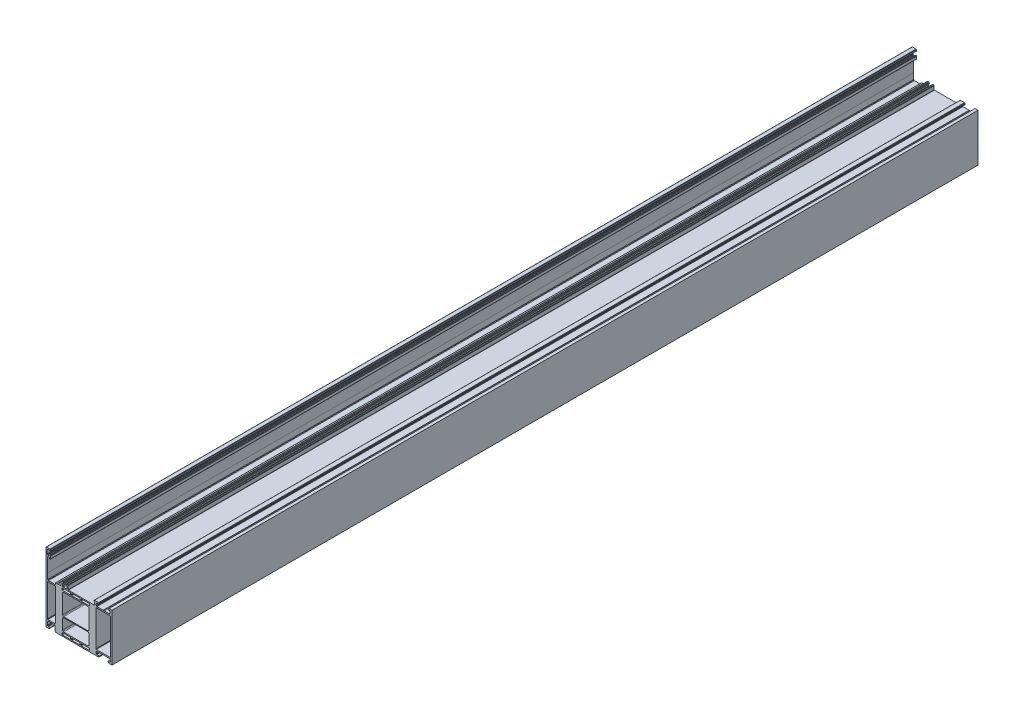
SolidWorks part; units mm, degrees
ref_plane "Ebene vorne" through (0, 0, 0) normal (0, 0, 1) x (1, 0, 0)
ref_plane "Ebene oben" through (0, 0, 0) normal (0, 1, 0) x (1, 0, 0)
ref_plane "Ebene rechts" through (0, 0, 0) normal (1, 0, 0) x (0, 0, -1)
sketch "Skizze1" plane through (0, 0, 0) normal (0, 0, 1) x (1, 0, 0)
  line L0 (15.4, 49) -> (16.2002, 49.0012)
  line L5 (1.85, 45.533) -> (1.9706, 45.583)
  line L6 (28.9408, 47.4176) -> (28.9038, 47.3119)
  line L7 (25.3003, 49.0607) -> (25.3415, 49.0285)
  line L8 (25.3415, 49.0285) -> (25.3896, 49.0079)
  line L9 (25.3896, 49.0079) -> (25.4414, 49.0001)
  line L10 (18.5413, 47.7007) -> (18.43, 47.6881)
  line L11 (47.2413, 44.1006) -> (20.2413, 44.1006)
  line L12 (20.2413, 44.1006) -> (19.9075, 44.063)
  line L13 (19.9075, 44.063) -> (19.5905, 43.9521)
  line L14 (19.5905, 43.9521) -> (19.3061, 43.7734)
  line L15 (19.3061, 43.7734) -> (19.0685, 43.5359)
  line L16 (19.0685, 43.5359) -> (18.8898, 43.2515)
  line L17 (18.8898, 43.2515) -> (18.7789, 42.9344)
  line L18 (18.7789, 42.9344) -> (18.7413, 42.6006)
  line L19 (18.7413, 42.6006) -> (18.7413, 21.6006)
  line L20 (1.6, 27) -> (1.6, 8.9)
  line L21 (1.6, 8.9) -> (1.6125, 8.7888)
  line L22 (1.6125, 8.7888) -> (1.6495, 8.6831)
  line L23 (1.6495, 8.6831) -> (1.7091, 8.5883)
  line L24 (1.7091, 8.5883) -> (1.7883, 8.5091)
  line L25 (1.7883, 8.5091) -> (1.8831, 8.4495)
  line L26 (1.8831, 8.4495) -> (1.9887, 8.4125)
  line L27 (1.9887, 8.4125) -> (2.1, 8.4)
  line L28 (2.1, 8.4) -> (10.3, 8.4)
  line L29 (10.3, 8.4) -> (10.4113, 8.4125)
  line L30 (10.4113, 8.4125) -> (10.5169, 8.4495)
  line L31 (10.5169, 8.4495) -> (10.6117, 8.5091)
  line L32 (10.6117, 8.5091) -> (10.6909, 8.5883)
  line L33 (10.6909, 8.5883) -> (10.7505, 8.6831)
  line L34 (10.7505, 8.6831) -> (10.7875, 8.7888)
  line L35 (10.7875, 8.7888) -> (10.8, 8.9)
  line L36 (10.8, 8.9) -> (10.8, 45.1)
  line L37 (10.8, 45.1) -> (10.7875, 45.2113)
  line L38 (10.7875, 45.2113) -> (10.7505, 45.317)
  line L39 (10.7505, 45.317) -> (10.6909, 45.4118)
  line L40 (10.6909, 45.4118) -> (10.6117, 45.4909)
  line L41 (10.6117, 45.4909) -> (10.5169, 45.5505)
  line L42 (10.5169, 45.5505) -> (10.4113, 45.5875)
  line L43 (10.4113, 45.5875) -> (10.3, 45.6)
  line L44 (10.3, 45.6) -> (2.1, 45.6)
  line L45 (2.1, 45.6) -> (1.9706, 45.583)
  line L46 (1.9706, 45.583) -> (1.85, 45.533)
  line L47 (1.85, 45.533) -> (1.7465, 45.4536)
  line L48 (1.7465, 45.4536) -> (1.667, 45.35)
  line L49 (1.667, 45.35) -> (1.617, 45.2294)
  line L50 (1.617, 45.2294) -> (1.6, 45.1)
  line L51 (1.6, 45.1) -> (1.6, 27)
  line L52 (0, 0) -> (0, 39.25)
  line L53 (0, 39.25) -> (0, 78.5)
  line L54 (0, 78.5) -> (0.0125, 78.6113)
  line L55 (0.0125, 78.6113) -> (0.0495, 78.7169)
  line L56 (0.0495, 78.7169) -> (0.1091, 78.8117)
  line L57 (0.1091, 78.8117) -> (0.1883, 78.8909)
  line L58 (0.1883, 78.8909) -> (0.2831, 78.9505)
  line L59 (0.2831, 78.9505) -> (0.3887, 78.9875)
  line L60 (0.3887, 78.9875) -> (0.5, 79)
  line L61 (0.5, 79) -> (4.5, 79)
  line L62 (4.5, 79) -> (4.6113, 78.9875)
  line L63 (4.6113, 78.9875) -> (4.7169, 78.9505)
  line L64 (4.7169, 78.9505) -> (4.8117, 78.8909)
  line L65 (4.8117, 78.8909) -> (4.8909, 78.8117)
  line L66 (4.8909, 78.8117) -> (4.9505, 78.7169)
  line L67 (4.9505, 78.7169) -> (4.9875, 78.6113)
  line L68 (4.9875, 78.6113) -> (5, 78.5)
  line L69 (5, 78.5) -> (5, 77.2)
  line L70 (5, 77.2) -> (4.9875, 77.0887)
  line L71 (4.9875, 77.0887) -> (4.9505, 76.983)
  line L72 (4.9505, 76.983) -> (4.8909, 76.8882)
  line L73 (4.8909, 76.8882) -> (4.8117, 76.8091)
  line L74 (4.8117, 76.8091) -> (4.7169, 76.7495)
  line L75 (4.7169, 76.7495) -> (4.6113, 76.7125)
  line L76 (4.6113, 76.7125) -> (4.5, 76.7)
  line L77 (4.5, 76.7) -> (4, 76.7)
  line L78 (4, 76.7) -> (4, 77.7)
  line L79 (4, 77.7) -> (2.3, 77.7)
  line L80 (2.3, 77.7) -> (2.0412, 77.6659)
  line L81 (2.0412, 77.6659) -> (1.8, 77.566)
  line L82 (1.8, 77.566) -> (1.5929, 77.4071)
  line L83 (1.5929, 77.4071) -> (1.434, 77.2)
  line L84 (1.434, 77.2) -> (1.3341, 76.9588)
  line L85 (1.3341, 76.9588) -> (1.3, 76.7)
  line L86 (1.3, 76.7) -> (1.3, 72.7)
  line L87 (1.3, 72.7) -> (1.3251, 72.4775)
  line L88 (1.3251, 72.4775) -> (1.399, 72.2661)
  line L89 (1.399, 72.2661) -> (1.5182, 72.0765)
  line L90 (1.5182, 72.0765) -> (1.6765, 71.9182)
  line L91 (1.6765, 71.9182) -> (1.8661, 71.799)
  line L92 (1.8661, 71.799) -> (2.0775, 71.7251)
  line L93 (2.0775, 71.7251) -> (2.3, 71.7)
  line L94 (2.3, 71.7) -> (4, 71.7)
  line L95 (4, 71.7) -> (4, 72.7)
  line L96 (4, 72.7) -> (4.5, 72.7)
  line L97 (4.5, 72.7) -> (4.6294, 72.683)
  line L98 (4.6294, 72.683) -> (4.75, 72.633)
  line L99 (4.75, 72.633) -> (4.8535, 72.5536)
  line L100 (4.8535, 72.5536) -> (4.933, 72.45)
  line L101 (4.933, 72.45) -> (4.983, 72.3294)
  line L102 (4.983, 72.3294) -> (5, 72.2)
  line L103 (5, 72.2) -> (5, 69.4)
  line L104 (5, 69.4) -> (4.9875, 69.2887)
  line L105 (4.9875, 69.2887) -> (4.9505, 69.1831)
  line L106 (4.9505, 69.1831) -> (4.8909, 69.0882)
  line L107 (4.8909, 69.0882) -> (4.8117, 69.0091)
  line L108 (4.8117, 69.0091) -> (4.7169, 68.9495)
  line L109 (4.7169, 68.9495) -> (4.6113, 68.9125)
  line L110 (4.6113, 68.9125) -> (4.5, 68.9)
  line L111 (4.5, 68.9) -> (4.3, 68.9)
  line L112 (4.3, 68.9) -> (4.1887, 68.9125)
  line L113 (4.1887, 68.9125) -> (4.0831, 68.9495)
  line L114 (4.0831, 68.9495) -> (3.9883, 69.0091)
  line L115 (3.9883, 69.0091) -> (3.9091, 69.0882)
  line L116 (3.9091, 69.0882) -> (3.8495, 69.1831)
  line L117 (3.8495, 69.1831) -> (3.8125, 69.2887)
  line L118 (3.8125, 69.2887) -> (3.8, 69.4)
  line L119 (3.8, 69.4) -> (3.8, 69.9)
  line L120 (3.8, 69.9) -> (3.783, 70.0294)
  line L121 (3.783, 70.0294) -> (3.733, 70.15)
  line L122 (3.733, 70.15) -> (3.6536, 70.2535)
  line L123 (3.6536, 70.2535) -> (3.55, 70.333)
  line L124 (3.55, 70.333) -> (3.4294, 70.383)
  line L125 (3.4294, 70.383) -> (3.3, 70.4)
  line L126 (3.3, 70.4) -> (2.1, 70.4)
  line L127 (2.1, 70.4) -> (1.9887, 70.3875)
  line L128 (1.9887, 70.3875) -> (1.8831, 70.3505)
  line L129 (1.8831, 70.3505) -> (1.7883, 70.2909)
  line L130 (1.7883, 70.2909) -> (1.7091, 70.2117)
  line L131 (1.7091, 70.2117) -> (1.6495, 70.1169)
  line L132 (1.6495, 70.1169) -> (1.6125, 70.0113)
  line L133 (1.6125, 70.0113) -> (1.6, 69.9)
  line L134 (1.6, 69.9) -> (1.6, 54)
  line L135 (1.6, 54) -> (1.9461, 47.943)
  line L136 (1.9461, 47.943) -> (1.992, 47.6956)
  line L137 (1.992, 47.6956) -> (2.0981, 47.4674)
  line L138 (2.0981, 47.4674) -> (2.2578, 47.273)
  line L139 (2.2578, 47.273) -> (2.461, 47.1246)
  line L140 (2.461, 47.1246) -> (2.6949, 47.0317)
  line L141 (2.6949, 47.0317) -> (2.9445, 47)
  line L142 (2.9445, 47) -> (10.1, 47)
  line L143 (10.1, 47) -> (10.2294, 47.017)
  line L144 (10.2294, 47.017) -> (10.35, 47.067)
  line L145 (10.35, 47.067) -> (10.4536, 47.1464)
  line L146 (10.4536, 47.1464) -> (10.533, 47.25)
  line L147 (10.533, 47.25) -> (10.583, 47.3706)
  line L148 (10.583, 47.3706) -> (10.6, 47.5)
  line L149 (10.6, 47.5) -> (10.6, 48.5)
  line L150 (10.6, 48.5) -> (10.6125, 48.6113)
  line L151 (10.6125, 48.6113) -> (10.6495, 48.7169)
  line L152 (10.6495, 48.7169) -> (10.7091, 48.8117)
  line L153 (10.7091, 48.8117) -> (10.7883, 48.8909)
  line L154 (10.7883, 48.8909) -> (10.8831, 48.9505)
  line L155 (10.8831, 48.9505) -> (10.9887, 48.9875)
  line L156 (10.9887, 48.9875) -> (11.1, 49)
  line L157 (11.1, 49) -> (12.5, 49)
  line L158 (12.5, 49) -> (12.5294, 48.9337)
  line L159 (12.5294, 48.9337) -> (12.5749, 48.8772)
  line L160 (12.5749, 48.8772) -> (12.6335, 48.8343)
  line L161 (12.6335, 48.8343) -> (12.7011, 48.808)
  line L162 (12.7011, 48.808) -> (12.7732, 48.8)
  line L163 (12.7732, 48.8) -> (13.2268, 48.8)
  line L164 (13.2268, 48.8) -> (13.2989, 48.808)
  line L165 (13.2989, 48.808) -> (13.3665, 48.8343)
  line L166 (13.3665, 48.8343) -> (13.4251, 48.8772)
  line L167 (13.4251, 48.8772) -> (13.4706, 48.9337)
  line L168 (13.4706, 48.9337) -> (13.5, 49)
  line L169 (13.5, 49) -> (15.4, 49)
  line L273 (15.3998, 0.1999) -> (13.4999, 0.1999)
  line L274 (13.4999, 0.1999) -> (13.4705, 0.2662)
  line L275 (13.4705, 0.2662) -> (13.4249, 0.3227)
  line L276 (13.4249, 0.3227) -> (13.3664, 0.3656)
  line L277 (13.3664, 0.3656) -> (13.2988, 0.3919)
  line L278 (13.2988, 0.3919) -> (13.2266, 0.3999)
  line L279 (13.2266, 0.3999) -> (12.7731, 0.3999)
  line L280 (12.7731, 0.3999) -> (12.701, 0.3919)
  line L281 (12.701, 0.3919) -> (12.6334, 0.3656)
  line L282 (12.6334, 0.3656) -> (12.5749, 0.3228)
  line L283 (12.5749, 0.3228) -> (12.5295, 0.2663)
  line L284 (12.5295, 0.2663) -> (12.5001, 0.2)
  line L285 (12.5001, 0.2) -> (11, 0.2)
  line L286 (11, 0.2) -> (10.8887, 0.2125)
  line L287 (10.8887, 0.2125) -> (10.7831, 0.2495)
  line L288 (10.7831, 0.2495) -> (10.6883, 0.3091)
  line L289 (10.6883, 0.3091) -> (10.6091, 0.3883)
  line L290 (10.6091, 0.3883) -> (10.5495, 0.4831)
  line L291 (10.5495, 0.4831) -> (10.5125, 0.5888)
  line L292 (10.5125, 0.5888) -> (10.5, 0.7)
  line L293 (10.5, 0.7) -> (10.5, 6.5)
  line L294 (10.5, 6.5) -> (10.4875, 6.6113)
  line L295 (10.4875, 6.6113) -> (10.4505, 6.7169)
  line L296 (10.4505, 6.7169) -> (10.3909, 6.8117)
  line L297 (10.3909, 6.8117) -> (10.3117, 6.8909)
  line L298 (10.3117, 6.8909) -> (10.2169, 6.9505)
  line L299 (10.2169, 6.9505) -> (10.1113, 6.9875)
  line L300 (10.1113, 6.9875) -> (10, 7)
  line L301 (10, 7) -> (2.8, 7)
  line L302 (2.8, 7) -> (2.5412, 6.9659)
  line L303 (2.5412, 6.9659) -> (2.3, 6.866)
  line L304 (2.3, 6.866) -> (2.0929, 6.7071)
  line L305 (2.0929, 6.7071) -> (1.934, 6.5)
  line L306 (1.934, 6.5) -> (1.8341, 6.2588)
  line L307 (1.8341, 6.2588) -> (1.8, 6)
  line L308 (1.8, 6) -> (1.8, 2.7)
  line L309 (1.8, 2.7) -> (1.8251, 2.4775)
  line L310 (1.8251, 2.4775) -> (1.899, 2.2661)
  line L311 (1.899, 2.2661) -> (2.0182, 2.0765)
  line L312 (2.0182, 2.0765) -> (2.1765, 1.9182)
  line L313 (2.1765, 1.9182) -> (2.3661, 1.799)
  line L314 (2.3661, 1.799) -> (2.5775, 1.7251)
  line L315 (2.5775, 1.7251) -> (2.8, 1.7)
  line L316 (2.8, 1.7) -> (4.5, 1.7)
  line L317 (4.5, 1.7) -> (4.5, 1.1)
  line L318 (4.5, 1.1) -> (3.4, 0)
  line L319 (3.4, 0) -> (0, 0)
  line L320 (29.04, 45.5493) -> (29.0795, 45.5097)
  line L321 (29.0795, 45.5097) -> (29.1743, 45.4502)
  line L322 (29.1743, 45.4502) -> (29.28, 45.4132)
  line L323 (29.28, 45.4132) -> (29.3913, 45.4006)
  line L324 (29.3913, 45.4006) -> (38.0913, 45.4006)
  line L325 (38.0913, 45.4006) -> (38.2207, 45.4177)
  line L326 (38.2207, 45.4177) -> (38.3413, 45.4676)
  line L327 (38.3413, 45.4676) -> (38.4448, 45.5471)
  line L328 (38.4448, 45.5471) -> (38.5243, 45.6506)
  line L329 (38.5243, 45.6506) -> (38.5743, 45.7712)
  line L330 (38.5743, 45.7712) -> (38.5913, 45.9006)
  line L331 (38.5913, 45.9006) -> (38.5913, 47.2007)
  line L332 (38.5913, 47.2007) -> (38.5788, 47.3119)
  line L333 (38.5788, 47.3119) -> (38.5418, 47.4176)
  line L334 (38.5418, 47.4176) -> (38.4822, 47.5124)
  line L335 (38.4822, 47.5124) -> (38.403, 47.5916)
  line L336 (38.403, 47.5916) -> (38.3082, 47.6511)
  line L337 (38.3082, 47.6511) -> (38.2026, 47.6881)
  line L338 (38.2026, 47.6881) -> (38.0913, 47.7007)
  line L339 (38.0913, 47.7007) -> (29.3913, 47.7007)
  line L340 (29.3913, 47.7007) -> (29.28, 47.6881)
  line L341 (29.28, 47.6881) -> (29.1743, 47.6511)
  line L342 (29.1743, 47.6511) -> (29.0795, 47.5916)
  line L343 (29.0795, 47.5916) -> (29.0004, 47.5124)
  line L344 (29.0004, 47.5124) -> (28.9408, 47.4176)
  line L345 (28.9408, 47.4176) -> (28.9038, 47.3119)
  line L346 (28.9038, 47.3119) -> (28.8913, 47.2007)
  line L347 (28.8913, 47.2007) -> (28.8913, 45.9006)
  line L348 (28.8913, 45.9006) -> (28.9038, 45.7894)
  line L349 (28.9038, 45.7894) -> (28.9408, 45.6837)
  line L350 (28.9408, 45.6837) -> (29.0004, 45.5889)
  line L351 (29.0004, 45.5889) -> (29.04, 45.5493)
  line L352 (22.9663, 47.7007) -> (18.5413, 47.7007)
  line L353 (18.5413, 47.7007) -> (18.43, 47.6881)
  line L354 (18.43, 47.6881) -> (18.3243, 47.6511)
  line L355 (18.3243, 47.6511) -> (18.2295, 47.5916)
  line L356 (18.2295, 47.5916) -> (18.1504, 47.5124)
  line L357 (18.1504, 47.5124) -> (18.0908, 47.4176)
  line L358 (18.0908, 47.4176) -> (18.0538, 47.3119)
  line L359 (18.0538, 47.3119) -> (18.0413, 47.2007)
  line L360 (18.0413, 47.2007) -> (18.0413, 45.9007)
  line L361 (18.0413, 45.9007) -> (18.0538, 45.7894)
  line L362 (18.0538, 45.7894) -> (18.0908, 45.6837)
  line L363 (18.0908, 45.6837) -> (18.1504, 45.5889)
  line L364 (18.1504, 45.5889) -> (18.2296, 45.5097)
  line L365 (18.2296, 45.5097) -> (18.3244, 45.4502)
  line L366 (18.3244, 45.4502) -> (18.43, 45.4132)
  line L367 (18.43, 45.4132) -> (18.5413, 45.4006)
  line L368 (18.5413, 45.4006) -> (27.3913, 45.4006)
  line L369 (27.3913, 45.4006) -> (27.4469, 45.4069)
  line L370 (27.4469, 45.4069) -> (27.5025, 45.4132)
  line L371 (27.5025, 45.4132) -> (27.6082, 45.4502)
  line L372 (27.6082, 45.4502) -> (27.703, 45.5097)
  line L373 (27.703, 45.5097) -> (27.7822, 45.5889)
  line L374 (27.7822, 45.5889) -> (27.8418, 45.6837)
  line L375 (27.8418, 45.6837) -> (27.8788, 45.7894)
  line L376 (27.8788, 45.7894) -> (27.8913, 45.9006)
  line L377 (27.8913, 45.9006) -> (27.8913, 47.2006)
  line L378 (27.8913, 47.2006) -> (27.8788, 47.3119)
  line L379 (27.8788, 47.3119) -> (27.8418, 47.4176)
  line L380 (27.8418, 47.4176) -> (27.7822, 47.5124)
  line L381 (27.7822, 47.5124) -> (27.703, 47.5916)
  line L382 (27.703, 47.5916) -> (27.6082, 47.6511)
  line L383 (27.6082, 47.6511) -> (27.5026, 47.6881)
  line L384 (27.5026, 47.6881) -> (27.3913, 47.7007)
  line L385 (27.3913, 47.7007) -> (22.9663, 47.7007)
  line L386 (25.4414, 49.0001) -> (38.362, 49.0001)
  line L387 (38.362, 49.0001) -> (44.8224, 49.0001)
  line L388 (44.8224, 49.0001) -> (52.1201, 49.0001)
  line L424 (47.2451, 44.1002) -> (33.7413, 44.1006)
  line L460 (16.2002, 49.0012) -> (17.0413, 49.0025)
  line L461 (17.0413, 49.0025) -> (17.0858, 49.0075)
  line L462 (17.0858, 49.0075) -> (17.1281, 49.0223)
  line L463 (17.1281, 49.0223) -> (17.166, 49.0462)
  line L464 (17.166, 49.0462) -> (17.1977, 49.0778)
  line L465 (17.1977, 49.0778) -> (17.2215, 49.1158)
  line L466 (17.2215, 49.1158) -> (17.2363, 49.158)
  line L467 (17.2363, 49.158) -> (17.2413, 49.2025)
  line L468 (17.2413, 49.2025) -> (17.2413, 53.3025)
  line L469 (17.2413, 53.3025) -> (17.2538, 53.4138)
  line L470 (17.2538, 53.4138) -> (17.2908, 53.5195)
  line L471 (17.2908, 53.5195) -> (17.3504, 53.6143)
  line L472 (17.3504, 53.6143) -> (17.4296, 53.6935)
  line L473 (17.4296, 53.6935) -> (17.5244, 53.753)
  line L474 (17.5244, 53.753) -> (17.63, 53.79)
  line L475 (17.63, 53.79) -> (17.7413, 53.8025)
  line L476 (17.7413, 53.8025) -> (18.572, 53.8025)
  line L477 (18.572, 53.8025) -> (18.8309, 53.7685)
  line L478 (18.8309, 53.7685) -> (19.072, 53.6686)
  line L479 (19.072, 53.6686) -> (19.2792, 53.5096)
  line L480 (19.2792, 53.5096) -> (19.4381, 53.3025)
  line L481 (19.4381, 53.3025) -> (19.538, 53.0614)
  line L482 (19.538, 53.0614) -> (19.7413, 52.3025)
  line L483 (19.7413, 52.3025) -> (18.7413, 52.3025)
  line L484 (18.7413, 52.3025) -> (18.7413, 50.0025)
  line L485 (18.7413, 50.0025) -> (18.7757, 49.7436)
  line L486 (18.7757, 49.7436) -> (18.8757, 49.5024)
  line L487 (18.8757, 49.5024) -> (19.0346, 49.2951)
  line L488 (19.0346, 49.2951) -> (19.2415, 49.1357)
  line L489 (19.2415, 49.1357) -> (19.4825, 49.0351)
  line L490 (19.4825, 49.0351) -> (19.7413, 49.0001)
  line L491 (19.7413, 49.0001) -> (22.7412, 49.0001)
  line L492 (22.7412, 49.0001) -> (23, 49.0351)
  line L493 (23, 49.0351) -> (23.2411, 49.1357)
  line L494 (23.2411, 49.1357) -> (23.448, 49.295)
  line L495 (23.448, 49.295) -> (23.6069, 49.5024)
  line L496 (23.6069, 49.5024) -> (23.7069, 49.7436)
  line L497 (23.7069, 49.7436) -> (23.7413, 50.0025)
  line L498 (23.7413, 50.0025) -> (23.7413, 52.3025)
  line L499 (23.7413, 52.3025) -> (22.7413, 52.3025)
  line L500 (22.7413, 52.3025) -> (22.9446, 53.0614)
  line L501 (22.9446, 53.0614) -> (23.0445, 53.3025)
  line L502 (23.0445, 53.3025) -> (23.2034, 53.5096)
  line L503 (23.2034, 53.5096) -> (23.4105, 53.6686)
  line L504 (23.4105, 53.6686) -> (23.6517, 53.7685)
  line L505 (23.6517, 53.7685) -> (23.9105, 53.8025)
  line L506 (23.9105, 53.8025) -> (24.7413, 53.8025)
  line L507 (24.7413, 53.8025) -> (24.8526, 53.79)
  line L508 (24.8526, 53.79) -> (24.9582, 53.753)
  line L509 (24.9582, 53.753) -> (25.053, 53.6934)
  line L510 (25.053, 53.6934) -> (25.1322, 53.6143)
  line L511 (25.1322, 53.6143) -> (25.1918, 53.5195)
  line L512 (25.1918, 53.5195) -> (25.2288, 53.4138)
  line L513 (25.2288, 53.4138) -> (25.2413, 53.3025)
  line L514 (25.2413, 53.3025) -> (25.2413, 49.2025)
  line L515 (25.2413, 49.2025) -> (25.2484, 49.1507)
  line L516 (25.2484, 49.1507) -> (25.2685, 49.1024)
  line L517 (25.2685, 49.1024) -> (25.3003, 49.0607)
  line L518 (25.3003, 49.0607) -> (25.4414, 49.0001)
  line L519 (48.7414, 17.5996) -> (48.7414, 6.5996)
  line L520 (48.7414, 6.5996) -> (48.7038, 6.2658)
  line L521 (48.7038, 6.2658) -> (48.5929, 5.9487)
  line L522 (48.5929, 5.9487) -> (48.4142, 5.6643)
  line L523 (48.4142, 5.6643) -> (48.1766, 5.4268)
  line L524 (48.1766, 5.4268) -> (47.8922, 5.2481)
  line L525 (47.8922, 5.2481) -> (47.5752, 5.1372)
  line L526 (47.5752, 5.1372) -> (47.2414, 5.0996)
  line L527 (47.2414, 5.0996) -> (20.2414, 5.0996)
  line L528 (20.2414, 5.0996) -> (19.9076, 5.1372)
  line L529 (19.9076, 5.1372) -> (19.5906, 5.2481)
  line L530 (19.5906, 5.2481) -> (19.3062, 5.4268)
  line L531 (19.3062, 5.4268) -> (19.0687, 5.6643)
  line L532 (19.0687, 5.6643) -> (18.89, 5.9487)
  line L533 (18.89, 5.9487) -> (18.779, 6.2658)
  line L534 (18.779, 6.2658) -> (18.7414, 6.5996)
  line L535 (18.7414, 6.5996) -> (18.7414, 17.5996)
  line L536 (18.7414, 17.5996) -> (18.779, 17.9334)
  line L537 (18.779, 17.9334) -> (18.89, 18.2504)
  line L538 (18.89, 18.2504) -> (19.0687, 18.5348)
  line L539 (19.0687, 18.5348) -> (19.3062, 18.7723)
  line L540 (19.3062, 18.7723) -> (19.5906, 18.951)
  line L541 (19.5906, 18.951) -> (19.9076, 19.062)
  line L542 (19.9076, 19.062) -> (20.2414, 19.0996)
  line L543 (20.2414, 19.0996) -> (47.2414, 19.0996)
  line L544 (47.2414, 19.0996) -> (47.5752, 19.062)
  line L545 (47.5752, 19.062) -> (47.8922, 18.951)
  line L546 (47.8922, 18.951) -> (48.1766, 18.7723)
  line L547 (48.1766, 18.7723) -> (48.4142, 18.5348)
  line L548 (48.4142, 18.5348) -> (48.5929, 18.2504)
  line L549 (48.5929, 18.2504) -> (48.7038, 17.9334)
  line L550 (48.7038, 17.9334) -> (48.7414, 17.5996)
  line L551 (38.3084, 3.75) -> (38.2027, 3.787)
  line L553 (27.6084, 3.75) -> (27.5027, 3.787)
  line L554 (39.6408, 47.4176) -> (39.6038, 47.3119)
  line L555 (47.5751, 44.063) -> (47.2413, 44.1006)
  line L556 (18.7413, 21.6006) -> (18.7789, 21.2669)
  line L557 (18.7789, 21.2669) -> (18.8898, 20.9498)
  line L558 (18.8898, 20.9498) -> (19.0685, 20.6654)
  line L559 (19.0685, 20.6654) -> (19.3061, 20.4279)
  line L560 (19.3061, 20.4279) -> (19.5905, 20.2492)
  line L561 (19.5905, 20.2492) -> (19.9075, 20.1382)
  line L562 (19.9075, 20.1382) -> (20.2413, 20.1006)
  line L563 (20.2413, 20.1006) -> (47.2413, 20.1006)
  line L564 (47.2413, 20.1006) -> (47.5751, 20.1382)
  line L565 (47.5751, 20.1382) -> (47.8921, 20.2492)
  line L566 (47.8921, 20.2492) -> (48.1765, 20.4279)
  line L567 (48.1765, 20.4279) -> (48.414, 20.6654)
  line L568 (48.414, 20.6654) -> (48.5927, 20.9498)
  line L569 (48.5927, 20.9498) -> (48.7037, 21.2669)
  line L570 (48.7037, 21.2669) -> (48.7413, 21.6006)
  line L571 (48.7413, 21.6006) -> (48.7413, 42.6006)
  line L572 (48.7413, 42.6006) -> (48.7037, 42.9344)
  line L573 (48.7037, 42.9344) -> (48.5927, 43.2515)
  line L574 (48.5927, 43.2515) -> (48.414, 43.5359)
  line L575 (48.414, 43.5359) -> (48.1765, 43.7734)
  line L576 (48.1765, 43.7734) -> (47.8921, 43.9521)
  line L577 (47.8921, 43.9521) -> (47.5751, 44.063)
  line L578 (73.3998, 27) -> (73.3998, 47)
  line L579 (73.3998, 47) -> (73.3828, 47.1294)
  line L580 (73.3828, 47.1294) -> (73.3328, 47.25)
  line L581 (73.3328, 47.25) -> (73.2534, 47.3535)
  line L582 (73.2534, 47.3535) -> (73.1498, 47.433)
  line L583 (73.1498, 47.433) -> (73.0292, 47.4829)
  line L584 (73.0292, 47.4829) -> (72.8998, 47.5)
  line L585 (72.8998, 47.5) -> (57.1998, 47.5)
  line L586 (57.1998, 47.5) -> (57.0704, 47.4829)
  line L587 (57.0704, 47.4829) -> (56.9498, 47.433)
  line L588 (56.9498, 47.433) -> (56.8463, 47.3535)
  line L589 (56.8463, 47.3535) -> (56.7668, 47.25)
  line L590 (56.7668, 47.25) -> (56.7169, 47.1294)
  line L591 (56.7169, 47.1294) -> (56.6998, 47)
  line L592 (56.6998, 47) -> (56.6998, 7.0001)
  line L593 (56.6998, 7.0001) -> (56.7169, 6.8707)
  line L594 (56.7169, 6.8707) -> (56.7668, 6.7501)
  line L595 (56.7668, 6.7501) -> (56.8463, 6.6465)
  line L596 (56.8463, 6.6465) -> (56.9498, 6.5671)
  line L597 (56.9498, 6.5671) -> (57.0704, 6.5171)
  line L598 (57.0704, 6.5171) -> (57.1998, 6.5001)
  line L599 (57.1998, 6.5001) -> (72.8998, 6.5001)
  line L600 (72.8998, 6.5001) -> (73.0292, 6.5171)
  line L601 (73.0292, 6.5171) -> (73.1498, 6.5671)
  line L602 (73.1498, 6.5671) -> (73.2534, 6.6465)
  line L603 (73.2534, 6.6465) -> (73.3328, 6.7501)
  line L604 (73.3328, 6.7501) -> (73.3828, 6.8707)
  line L605 (73.3828, 6.8707) -> (73.3998, 7.0001)
  line L606 (73.3998, 7.0001) -> (73.3998, 27)
  line L607 (74.9998, 54) -> (74.9998, 27)
  line L608 (74.9998, 27) -> (74.9998, 0.0001)
  line L609 (74.9998, 0.0001) -> (71.5998, 0.0001)
  line L610 (71.5998, 0.0001) -> (70.4998, 1.1001)
  line L611 (70.4998, 1.1001) -> (70.4998, 1.7001)
  line L612 (70.4998, 1.7001) -> (72.2998, 1.7001)
  line L613 (72.2998, 1.7001) -> (72.5587, 1.7342)
  line L614 (72.5587, 1.7342) -> (72.7998, 1.8341)
  line L615 (72.7998, 1.8341) -> (73.0069, 1.993)
  line L616 (73.0069, 1.993) -> (73.1658, 2.2001)
  line L617 (73.1658, 2.2001) -> (73.2658, 2.4413)
  line L618 (73.2658, 2.4413) -> (73.2998, 2.7001)
  line L619 (73.2998, 2.7001) -> (73.2998, 4.0001)
  line L620 (73.2998, 4.0001) -> (73.2658, 4.2589)
  line L621 (73.2658, 4.2589) -> (73.1659, 4.5001)
  line L622 (73.1659, 4.5001) -> (73.0069, 4.7072)
  line L623 (73.0069, 4.7072) -> (72.7998, 4.8661)
  line L624 (72.7998, 4.8661) -> (72.5587, 4.966)
  line L625 (72.5587, 4.966) -> (72.2998, 5.0001)
  line L626 (72.2998, 5.0001) -> (65.9998, 5.0001)
  line L627 (65.9998, 5.0001) -> (65.8521, 5.1088)
  line L628 (65.8521, 5.1088) -> (65.6818, 5.1769)
  line L629 (65.6818, 5.1769) -> (65.4998, 5.2001)
  line L630 (65.4998, 5.2001) -> (65.3179, 5.1769)
  line L631 (65.3179, 5.1769) -> (65.1476, 5.1088)
  line L632 (65.1476, 5.1088) -> (64.9998, 5.0001)
  line L633 (64.9998, 5.0001) -> (57.9998, 5.0001)
  line L634 (57.9998, 5.0001) -> (57.7773, 4.975)
  line L635 (57.7773, 4.975) -> (57.5659, 4.901)
  line L636 (57.5659, 4.901) -> (57.3763, 4.7819)
  line L637 (57.3763, 4.7819) -> (57.218, 4.6236)
  line L638 (57.218, 4.6236) -> (57.0988, 4.434)
  line L639 (57.0988, 4.434) -> (57.0249, 4.2226)
  line L640 (57.0249, 4.2226) -> (56.9998, 4.0001)
  line L641 (56.9998, 4.0001) -> (56.9998, 2.7001)
  line L642 (56.9998, 2.7001) -> (57.0339, 2.4413)
  line L643 (57.0339, 2.4413) -> (57.1338, 2.2001)
  line L644 (57.1338, 2.2001) -> (57.2927, 1.993)
  line L645 (57.2927, 1.993) -> (57.4998, 1.8341)
  line L646 (57.4998, 1.8341) -> (57.741, 1.7342)
  line L647 (57.741, 1.7342) -> (57.9998, 1.7001)
  line L648 (57.9998, 1.7001) -> (60.4998, 1.7001)
  line L649 (60.4998, 1.7001) -> (60.4998, 1.2001)
  line L650 (60.4998, 1.2001) -> (60.4657, 0.9413)
  line L651 (60.4657, 0.9413) -> (60.3658, 0.7001)
  line L652 (60.3658, 0.7001) -> (60.2069, 0.493)
  line L653 (60.2069, 0.493) -> (59.9998, 0.3341)
  line L654 (59.9998, 0.3341) -> (59.7586, 0.2342)
  line L655 (59.7586, 0.2342) -> (59.4998, 0.2001)
  line L656 (59.4998, 0.2001) -> (55.0001, 0.2001)
  line L657 (55.0001, 0.2001) -> (54.9708, 0.2664)
  line L658 (54.9708, 0.2664) -> (54.9252, 0.3229)
  line L659 (54.9252, 0.3229) -> (54.8667, 0.3658)
  line L660 (54.8667, 0.3658) -> (54.7991, 0.3921)
  line L661 (54.7991, 0.3921) -> (54.727, 0.4001)
  line L662 (54.727, 0.4001) -> (54.2734, 0.4001)
  line L663 (54.2734, 0.4001) -> (54.2012, 0.3921)
  line L664 (54.2012, 0.3921) -> (54.1336, 0.3658)
  line L665 (54.1336, 0.3658) -> (54.0751, 0.3229)
  line L666 (54.0751, 0.3229) -> (54.0296, 0.2664)
  line L667 (54.0296, 0.2664) -> (54.0002, 0.2001)
  line L668 (54.0002, 0.2001) -> (52.1201, 0.2001)
  line L773 (52.1201, 49.0001) -> (54.0001, 49.0001)
  line L774 (54.0001, 49.0001) -> (54.0295, 48.9338)
  line L775 (54.0295, 48.9338) -> (54.075, 48.8772)
  line L776 (54.075, 48.8772) -> (54.1336, 48.8344)
  line L777 (54.1336, 48.8344) -> (54.2012, 48.8081)
  line L778 (54.2012, 48.8081) -> (54.2733, 48.8001)
  line L779 (54.2733, 48.8001) -> (54.7269, 48.8001)
  line L780 (54.7269, 48.8001) -> (54.7892, 48.8059)
  line L781 (54.7892, 48.8059) -> (54.8487, 48.8254)
  line L782 (54.8487, 48.8254) -> (54.9024, 48.8577)
  line L783 (54.9024, 48.8577) -> (54.9474, 48.9011)
  line L784 (54.9474, 48.9011) -> (54.9817, 48.9535)
  line L785 (54.9817, 48.9535) -> (55.0034, 49.0123)
  line L786 (55.0034, 49.0123) -> (55.0803, 49.0232)
  line L787 (55.0803, 49.0232) -> (55.1519, 49.0536)
  line L788 (55.1519, 49.0536) -> (55.2132, 49.1014)
  line L789 (55.2132, 49.1014) -> (55.2602, 49.1633)
  line L790 (55.2602, 49.1633) -> (55.2898, 49.2352)
  line L791 (55.2898, 49.2352) -> (55.2998, 49.3122)
  line L792 (55.2998, 49.3122) -> (55.2998, 52.3)
  line L793 (55.2998, 52.3) -> (54.4998, 52.3)
  line L794 (54.4998, 52.3) -> (54.4998, 53.3)
  line L795 (54.4998, 53.3) -> (54.5124, 53.4112)
  line L796 (54.5124, 53.4112) -> (54.5493, 53.5169)
  line L797 (54.5493, 53.5169) -> (54.6089, 53.6117)
  line L798 (54.6089, 53.6117) -> (54.6881, 53.6909)
  line L799 (54.6881, 53.6909) -> (54.7829, 53.7505)
  line L800 (54.7829, 53.7505) -> (54.8886, 53.7874)
  line L801 (54.8886, 53.7874) -> (54.9998, 53.8)
  line L802 (54.9998, 53.8) -> (59.4998, 53.8)
  line L803 (59.4998, 53.8) -> (59.7586, 53.7659)
  line L804 (59.7586, 53.7659) -> (59.9998, 53.666)
  line L805 (59.9998, 53.666) -> (60.2069, 53.5071)
  line L806 (60.2069, 53.5071) -> (60.3658, 53.3)
  line L807 (60.3658, 53.3) -> (60.4657, 53.0588)
  line L808 (60.4657, 53.0588) -> (60.4998, 52.8)
  line L809 (60.4998, 52.8) -> (60.4998, 52.3)
  line L810 (60.4998, 52.3) -> (57.9998, 52.3)
  line L811 (57.9998, 52.3) -> (57.741, 52.2659)
  line L812 (57.741, 52.2659) -> (57.4998, 52.166)
  line L813 (57.4998, 52.166) -> (57.2927, 52.0071)
  line L814 (57.2927, 52.0071) -> (57.1338, 51.8)
  line L815 (57.1338, 51.8) -> (57.0339, 51.5588)
  line L816 (57.0339, 51.5588) -> (56.9998, 51.3)
  line L817 (56.9998, 51.3) -> (56.9998, 50)
  line L818 (56.9998, 50) -> (57.0339, 49.7412)
  line L819 (57.0339, 49.7412) -> (57.1338, 49.5)
  line L820 (57.1338, 49.5) -> (57.2927, 49.2929)
  line L821 (57.2927, 49.2929) -> (57.4998, 49.134)
  line L822 (57.4998, 49.134) -> (57.741, 49.0341)
  line L823 (57.741, 49.0341) -> (57.9998, 49)
  line L824 (57.9998, 49) -> (64.9998, 49)
  line L825 (64.9998, 49) -> (65.1476, 48.8913)
  line L826 (65.1476, 48.8913) -> (65.3179, 48.8231)
  line L827 (65.3179, 48.8231) -> (65.4998, 48.7999)
  line L828 (65.4998, 48.7999) -> (65.6818, 48.8231)
  line L829 (65.6818, 48.8231) -> (65.8521, 48.8913)
  line L830 (65.8521, 48.8913) -> (65.9998, 49)
  line L831 (65.9998, 49) -> (72.0003, 49)
  line L832 (72.0003, 49) -> (72.2591, 49.0341)
  line L833 (72.2591, 49.0341) -> (72.5003, 49.134)
  line L834 (72.5003, 49.134) -> (72.7074, 49.2929)
  line L835 (72.7074, 49.2929) -> (72.8663, 49.5)
  line L836 (72.8663, 49.5) -> (72.9662, 49.7412)
  line L837 (72.9662, 49.7412) -> (73.0003, 50)
  line L838 (73.0003, 50) -> (73.0003, 51.3)
  line L839 (73.0003, 51.3) -> (72.9662, 51.5588)
  line L840 (72.9662, 51.5588) -> (72.8663, 51.8)
  line L841 (72.8663, 51.8) -> (72.7074, 52.0071)
  line L842 (72.7074, 52.0071) -> (72.5003, 52.166)
  line L843 (72.5003, 52.166) -> (72.2591, 52.2659)
  line L844 (72.2591, 52.2659) -> (72.0003, 52.3)
  line L845 (72.0003, 52.3) -> (70.4998, 52.3)
  line L846 (70.4998, 52.3) -> (70.4998, 52.9)
  line L847 (70.4998, 52.9) -> (71.5998, 54)
  line L848 (71.5998, 54) -> (74.9998, 54)
  line L849 (48.9969, 47.6944) -> (48.9413, 47.7007)
  line L850 (48.9413, 47.7007) -> (40.0913, 47.7007)
  line L851 (40.0913, 47.7007) -> (39.98, 47.6881)
  line L852 (39.98, 47.6881) -> (39.8743, 47.6511)
  line L853 (39.8743, 47.6511) -> (39.7795, 47.5916)
  line L854 (39.7795, 47.5916) -> (39.7004, 47.5124)
  line L855 (39.7004, 47.5124) -> (39.6408, 47.4176)
  line L856 (39.6408, 47.4176) -> (39.6038, 47.3119)
  line L857 (39.6038, 47.3119) -> (39.5913, 47.2006)
  line L858 (39.5913, 47.2006) -> (39.5913, 45.9006)
  line L859 (39.5913, 45.9006) -> (39.6038, 45.7894)
  line L860 (39.6038, 45.7894) -> (39.6408, 45.6837)
  line L861 (39.6408, 45.6837) -> (39.7004, 45.5889)
  line L862 (39.7004, 45.5889) -> (39.7795, 45.5097)
  line L863 (39.7795, 45.5097) -> (39.8743, 45.4502)
  line L864 (39.8743, 45.4502) -> (39.98, 45.4132)
  line L865 (39.98, 45.4132) -> (40.0913, 45.4006)
  line L866 (40.0913, 45.4006) -> (48.9413, 45.4006)
  line L867 (48.9413, 45.4006) -> (49.0525, 45.4132)
  line L868 (49.0525, 45.4132) -> (49.1582, 45.4502)
  line L869 (49.1582, 45.4502) -> (49.253, 45.5097)
  line L870 (49.253, 45.5097) -> (49.3322, 45.5889)
  line L871 (49.3322, 45.5889) -> (49.3918, 45.6837)
  line L872 (49.3918, 45.6837) -> (49.4288, 45.7894)
  line L873 (49.4288, 45.7894) -> (49.4413, 45.9006)
  line L874 (49.4413, 45.9006) -> (49.4413, 47.2006)
  line L875 (49.4413, 47.2006) -> (49.4288, 47.3119)
  line L876 (49.4288, 47.3119) -> (49.3918, 47.4176)
  line L877 (49.3918, 47.4176) -> (49.3322, 47.5124)
  line L878 (49.3322, 47.5124) -> (49.253, 47.5916)
  line L879 (49.253, 47.5916) -> (49.1582, 47.6511)
  line L880 (49.1582, 47.6511) -> (49.0525, 47.6881)
  line L881 (49.0525, 47.6881) -> (48.9969, 47.6944)
  line L882 (38.147, 3.7933) -> (38.0914, 3.7996)
  line L883 (38.0914, 3.7996) -> (29.3914, 3.7996)
  line L884 (29.3914, 3.7996) -> (29.262, 3.7825)
  line L885 (29.262, 3.7825) -> (29.1414, 3.7326)
  line L886 (29.1414, 3.7326) -> (29.0379, 3.6531)
  line L887 (29.0379, 3.6531) -> (28.9584, 3.5496)
  line L888 (28.9584, 3.5496) -> (28.9084, 3.429)
  line L889 (28.9084, 3.429) -> (28.8914, 3.2996)
  line L890 (28.8914, 3.2996) -> (28.8914, 1.9996)
  line L891 (28.8914, 1.9996) -> (28.9039, 1.8883)
  line L892 (28.9039, 1.8883) -> (28.9409, 1.7826)
  line L893 (28.9409, 1.7826) -> (29.0005, 1.6878)
  line L894 (29.0005, 1.6878) -> (29.0797, 1.6086)
  line L895 (29.0797, 1.6086) -> (29.1745, 1.5491)
  line L896 (29.1745, 1.5491) -> (29.2801, 1.5121)
  line L897 (29.2801, 1.5121) -> (29.3914, 1.4996)
  line L898 (29.3914, 1.4996) -> (38.0914, 1.4996)
  line L899 (38.0914, 1.4996) -> (38.2027, 1.5121)
  line L900 (38.2027, 1.5121) -> (38.3084, 1.5491)
  line L901 (38.3084, 1.5491) -> (38.4032, 1.6086)
  line L902 (38.4032, 1.6086) -> (38.4823, 1.6878)
  line L903 (38.4823, 1.6878) -> (38.5419, 1.7826)
  line L904 (38.5419, 1.7826) -> (38.5789, 1.8883)
  line L905 (38.5789, 1.8883) -> (38.5914, 1.9996)
  line L906 (38.5914, 1.9996) -> (38.5914, 3.2996)
  line L907 (38.5914, 3.2996) -> (38.5789, 3.4108)
  line L908 (38.5789, 3.4108) -> (38.5419, 3.5165)
  line L909 (38.5419, 3.5165) -> (38.4823, 3.6113)
  line L910 (38.4823, 3.6113) -> (38.4032, 3.6905)
  line L911 (38.4032, 3.6905) -> (38.3084, 3.75)
  line L912 (38.3084, 3.75) -> (38.2027, 3.787)
  line L913 (38.2027, 3.787) -> (38.147, 3.7933)
  line L914 (40.0358, 1.5058) -> (40.0914, 1.4996)
  line L915 (40.0914, 1.4996) -> (48.9414, 1.4996)
  line L916 (48.9414, 1.4996) -> (49.0527, 1.5121)
  line L917 (49.0527, 1.5121) -> (49.1584, 1.5491)
  line L918 (49.1584, 1.5491) -> (49.2532, 1.6086)
  line L919 (49.2532, 1.6086) -> (49.3323, 1.6878)
  line L920 (49.3323, 1.6878) -> (49.3919, 1.7826)
  line L921 (49.3919, 1.7826) -> (49.4289, 1.8883)
  line L922 (49.4289, 1.8883) -> (49.4414, 1.9995)
  line L923 (49.4414, 1.9995) -> (49.4414, 3.2995)
  line L924 (49.4414, 3.2995) -> (49.4289, 3.4108)
  line L925 (49.4289, 3.4108) -> (49.3919, 3.5165)
  line L926 (49.3919, 3.5165) -> (49.3323, 3.6113)
  line L927 (49.3323, 3.6113) -> (49.2531, 3.6905)
  line L928 (49.2531, 3.6905) -> (49.1583, 3.75)
  line L929 (49.1583, 3.75) -> (49.0527, 3.787)
  line L930 (49.0527, 3.787) -> (48.9414, 3.7996)
  line L931 (48.9414, 3.7996) -> (40.0914, 3.7996)
  line L932 (40.0914, 3.7996) -> (40.0358, 3.7933)
  line L933 (40.0358, 3.7933) -> (39.9802, 3.787)
  line L934 (39.9802, 3.787) -> (39.8745, 3.75)
  line L935 (39.8745, 3.75) -> (39.7797, 3.6905)
  line L936 (39.7797, 3.6905) -> (39.7005, 3.6113)
  line L937 (39.7005, 3.6113) -> (39.6409, 3.5165)
  line L938 (39.6409, 3.5165) -> (39.604, 3.4108)
  line L939 (39.604, 3.4108) -> (39.5914, 3.2996)
  line L940 (39.5914, 3.2996) -> (39.5914, 1.9996)
  line L941 (39.5914, 1.9996) -> (39.6039, 1.8883)
  line L942 (39.6039, 1.8883) -> (39.6409, 1.7826)
  line L943 (39.6409, 1.7826) -> (39.7005, 1.6878)
  line L944 (39.7005, 1.6878) -> (39.7797, 1.6086)
  line L945 (39.7797, 1.6086) -> (39.8745, 1.5491)
  line L946 (39.8745, 1.5491) -> (39.9802, 1.5121)
  line L947 (39.9802, 1.5121) -> (40.0358, 1.5058)
  line L948 (18.4858, 1.5058) -> (18.5414, 1.4996)
  line L949 (18.5414, 1.4996) -> (27.3914, 1.4996)
  line L950 (27.3914, 1.4996) -> (27.5027, 1.5121)
  line L951 (27.5027, 1.5121) -> (27.6084, 1.5491)
  line L952 (27.6084, 1.5491) -> (27.7032, 1.6086)
  line L953 (27.7032, 1.6086) -> (27.7823, 1.6878)
  line L954 (27.7823, 1.6878) -> (27.8419, 1.7826)
  line L955 (27.8419, 1.7826) -> (27.8789, 1.8883)
  line L956 (27.8789, 1.8883) -> (27.8914, 1.9996)
  line L957 (27.8914, 1.9996) -> (27.8914, 3.2996)
  line L958 (27.8914, 3.2996) -> (27.8789, 3.4108)
  line L959 (27.8789, 3.4108) -> (27.8419, 3.5165)
  line L960 (27.8419, 3.5165) -> (27.7823, 3.6113)
  line L961 (27.7823, 3.6113) -> (27.7032, 3.6905)
  line L962 (27.7032, 3.6905) -> (27.6084, 3.75)
  line L963 (27.6084, 3.75) -> (27.5027, 3.787)
  line L964 (27.5027, 3.787) -> (27.3914, 3.7996)
  line L965 (27.3914, 3.7996) -> (18.5414, 3.7996)
  line L966 (18.5414, 3.7996) -> (18.4302, 3.787)
  line L967 (18.4302, 3.787) -> (18.3245, 3.75)
  line L968 (18.3245, 3.75) -> (18.2297, 3.6905)
  line L969 (18.2297, 3.6905) -> (18.1505, 3.6113)
  line L970 (18.1505, 3.6113) -> (18.0909, 3.5165)
  line L971 (18.0909, 3.5165) -> (18.0539, 3.4108)
  line L972 (18.0539, 3.4108) -> (18.0414, 3.2996)
  line L973 (18.0414, 3.2996) -> (18.0414, 1.9996)
  line L974 (18.0414, 1.9996) -> (18.0539, 1.8883)
  line L975 (18.0539, 1.8883) -> (18.0909, 1.7826)
  line L976 (18.0909, 1.7826) -> (18.1505, 1.6878)
  line L977 (18.1505, 1.6878) -> (18.2297, 1.6086)
  line L978 (18.2297, 1.6086) -> (18.3245, 1.5491)
  line L979 (18.3245, 1.5491) -> (18.4302, 1.5121)
  line L980 (18.4302, 1.5121) -> (18.4858, 1.5058)
  line L981 (52.1201, 0.2001) -> (33.7412, 0.1995)
  line L982 (33.7412, 0.1995) -> (24.9706, 0.1998)
  line L983 (24.9706, 0.1998) -> (15.3998, 0.1999)
  line L1018 (20.2376, 5.1) -> (33.7572, 5.0996)
extrude "Aufsatz-Linear austragen3" add sketch "Skizze1" along normal blind 984 contours L983 L982 L981 L668 L667 L666 L665 L664 L663 L662 L661 L660 L659 L658 L657 L656 L655 L654 L653 L652 L651 L650 L649 L648 L647 L646 L645 L644 L643 L642 L641 L640 L639 L638 L637 L636 L635 L634 L633 L632 L631 L630 L629 L628 L627 L626 L625 L624 L623 L622 L621
